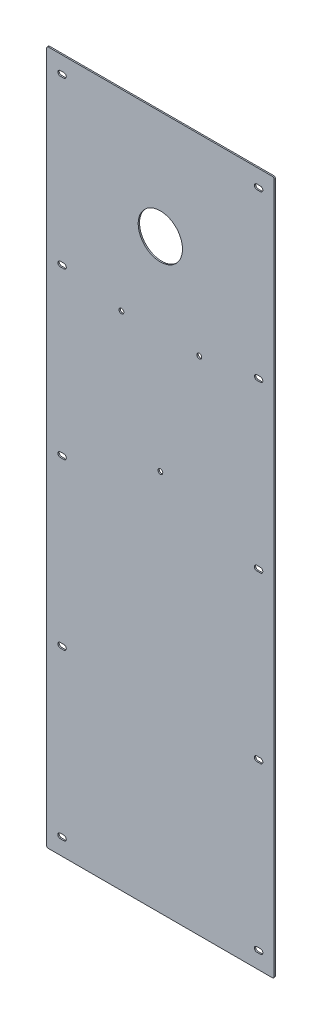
SolidWorks part; units mm, degrees
ref_plane "Ebene vorne" through (0, 0, 0) normal (0, 0, 1) x (1, 0, 0)
ref_plane "Ebene oben" through (0, 0, 0) normal (0, 1, 0) x (1, 0, 0)
ref_plane "Ebene rechts" through (0, 0, 0) normal (1, 0, 0) x (0, 0, -1)
sketch "Skizze1" plane through (0, 0, 0) normal (0, 0, 1) x (1, 0, 0)
  line L1 (-128.5, -392) -> (128.5, -392)
  line L2 (-128.5, -392) -> (-128.5, 392)
  line L3 (-128.5, 392) -> (128.5, 392)
  line L4 (128.5, -392) -> (128.5, 392)
  line L5 (-128.5, -392) -> (128.5, 392) construction
  line L6 (-128.5, 392) -> (128.5, -392) construction
  point P0 (0, 0)
  dimension "D1" = 257
  dimension "D2" = 784
extrude "Aufsatz-Linear austragen1" add sketch "Skizze1" along normal blind 1.5
sketch "Skizze2" plane through (0, 0, 1.5) normal (0, 0, 1) x (1, 0, 0)
  line L0 (128.5, 392) -> (-128.5, 392) construction
  line L1 (-89, 10) -> (89, 10)
  line L2 (-94, 15) -> (-94, 323)
  line L3 (-89, 328) -> (89, 328)
  line L4 (94, 15) -> (94, 323)
  line L5 (-94, 10) -> (94, 328) construction
  line L6 (-94, 328) -> (94, 10) construction
  arc A0 (94, 15) -> (89, 10) centre (89, 15) cw
  arc A1 (-94, 15) -> (-89, 10) centre (-89, 15) ccw
  arc A2 (94, 323) -> (89, 328) centre (89, 323) ccw
  arc A3 (-89, 328) -> (-94, 323) centre (-89, 323) ccw
  point P0 (0, 169)
  dimension "D3" = 5
  dimension "D1" = 188
  dimension "D2" = 64
  dimension "D4" = 10
extrude "Schnitt-Linear austragen1" [suppressed] cut sketch "Skizze2" against normal through all
hole_wizard "Durchgangsloch für M51" positions "Skizze3" profile "Skizze4" hole size "M5" standard "DIN"
sketch "Skizze3" plane through (0, 0, 1.5) normal (0, 0, 1) x (1, 0, 0)
  line L0 (-111, 373) -> (-111, 0) construction
  line L1 (-111, 0) -> (-111, -373) construction
  line L2 (-111, -373) -> (111, -373) construction
  line L3 (111, -373) -> (111, 0) construction
  line L4 (111, 0) -> (111, 373) construction
  line L5 (111, 373) -> (-111, 373) construction
  line L7 (0, 0) -> (0, 373) construction
  line L9 (128.5, 392) -> (-128.5, 392) construction
  line L10 (128.5, -392) -> (128.5, 392) construction
  line L11 (-128.5, -392) -> (128.5, -392) construction
  point P1 (-111, 373)
  point P2 (-111, 0)
  point P4 (-111, -373)
  point P6 (111, -373)
  point P8 (111, 0)
  point P10 (111, 373)
  point P29 (-111, -186.5)
  point P31 (111, -186.5)
  point P33 (-111, 186.5)
  point P35 (111, 186.5)
  dimension "D1" = 19
  dimension "D2" = 17.5
  dimension "D3" = 19
  dimension "D4" = 0
sketch "Skizze4" plane through (-111, 373, 1.5) normal (1, 0, 0) x (0, -1, 0)
  line L0 (0, 0) -> (0, 1.5)
  line L1 (0, 1.5) -> (2.75, 1.5)
  line L2 (2.75, 1.5) -> (2.75, 0)
  line L5 (2.75, 0) -> (0, 0)
  line L11 (0, -6.35) -> (0, 107.95) construction
  dimension "Bohrerdurchmesser" = 5.5
  dimension "Bohrungstiefe" = 1.5
sketch "Skizze13" plane through (0, 0, 1.5) normal (0, 0, 1) x (1, 0, 0)
  line L0 (-113, 373) -> (-109, 373) construction
  line L1 (-113, 375.75) -> (-109, 375.75)
  line L2 (-113, 370.25) -> (-109, 370.25)
  line L3 (-113, 186.5) -> (-109, 186.5) construction
  line L4 (-113, 189.25) -> (-109, 189.25)
  line L5 (-113, 183.75) -> (-109, 183.75)
  line L6 (-113, 0) -> (-109, 0) construction
  line L7 (-113, 2.75) -> (-109, 2.75)
  line L8 (-113, -2.75) -> (-109, -2.75)
  line L9 (-113, -186.5) -> (-109, -186.5) construction
  line L10 (-113, -183.75) -> (-109, -183.75)
  line L11 (-113, -189.25) -> (-109, -189.25)
  line L12 (-113, -373) -> (-109, -373) construction
  line L13 (-113, -370.25) -> (-109, -370.25)
  line L14 (-113, -375.75) -> (-109, -375.75)
  line L15 (0, 0) -> (0, 442.1579) construction
  line L16 (113, 373) -> (109, 373) construction
  line L17 (113, 375.75) -> (109, 375.75)
  line L18 (113, 370.25) -> (109, 370.25)
  line L19 (113, 186.5) -> (109, 186.5) construction
  line L20 (113, 189.25) -> (109, 189.25)
  line L21 (113, 183.75) -> (109, 183.75)
  line L22 (113, 0) -> (109, 0) construction
  line L23 (113, 2.75) -> (109, 2.75)
  line L24 (113, -2.75) -> (109, -2.75)
  line L25 (113, -186.5) -> (109, -186.5) construction
  line L26 (113, -183.75) -> (109, -183.75)
  line L27 (113, -189.25) -> (109, -189.25)
  line L28 (113, -373) -> (109, -373) construction
  line L29 (113, -370.25) -> (109, -370.25)
  line L30 (113, -375.75) -> (109, -375.75)
  arc A0 (-113, 375.75) -> (-113, 370.25) centre (-113, 373) ccw
  arc A1 (-109, 370.25) -> (-109, 375.75) centre (-109, 373) ccw
  circle A2 centre (-111, 373) radius 2.75 construction
  arc A3 (-113, 189.25) -> (-113, 183.75) centre (-113, 186.5) ccw
  arc A4 (-109, 183.75) -> (-109, 189.25) centre (-109, 186.5) ccw
  arc A5 (-113, 2.75) -> (-113, -2.75) centre (-113, 0) ccw
  arc A6 (-109, -2.75) -> (-109, 2.75) centre (-109, 0) ccw
  arc A7 (-113, -183.75) -> (-113, -189.25) centre (-113, -186.5) ccw
  arc A8 (-109, -189.25) -> (-109, -183.75) centre (-109, -186.5) ccw
  arc A9 (-113, -370.25) -> (-113, -375.75) centre (-113, -373) ccw
  arc A10 (-109, -375.75) -> (-109, -370.25) centre (-109, -373) ccw
  arc A11 (113, 375.75) -> (113, 370.25) centre (113, 373) cw
  arc A12 (109, 370.25) -> (109, 375.75) centre (109, 373) cw
  arc A13 (113, 189.25) -> (113, 183.75) centre (113, 186.5) cw
  arc A14 (109, 183.75) -> (109, 189.25) centre (109, 186.5) cw
  arc A15 (113, 2.75) -> (113, -2.75) centre (113, 0) cw
  arc A16 (109, -2.75) -> (109, 2.75) centre (109, 0) cw
  arc A17 (113, -183.75) -> (113, -189.25) centre (113, -186.5) cw
  arc A18 (109, -189.25) -> (109, -183.75) centre (109, -186.5) cw
  arc A19 (113, -370.25) -> (113, -375.75) centre (113, -373) cw
  arc A20 (109, -375.75) -> (109, -370.25) centre (109, -373) cw
  point P2 (-111, 373)
  point P12 (-111, 186.5)
  point P19 (-111, 0)
  point P28 (-111, -186.5)
  point P36 (-111, -373)
  point P48 (111, 373)
  point P55 (111, 186.5)
  point P62 (111, 0)
  point P69 (111, -186.5)
  point P76 (111, -373)
  dimension "D1" = 4
extrude "Schnitt-Linear austragen6" cut sketch "Skizze13" against normal through all
sketch "Skizze5" plane through (0, 0, 1.5) normal (0, 0, 1) x (1, 0, 0)
  line L0 (0, 0) -> (0, -392) construction
  line L1 (-128.5, -392) -> (128.5, -392) construction
  line L3 (-46, -392) -> (46, -392)
  line L4 (-46, -392) -> (-46, -319)
  line L5 (-41, -314) -> (41, -314)
  line L6 (46, -392) -> (46, -319)
  arc A0 (46, -319) -> (41, -314) centre (41, -319) ccw
  arc A1 (-41, -314) -> (-46, -319) centre (-41, -319) ccw
  point P12 (46, -314)
  point P15 (-46, -314)
  dimension "D3" = 5
  dimension "D1" = 78
  dimension "D2" = 92
extrude "Schnitt-Linear austragen2" [suppressed] cut sketch "Skizze5" against normal through all
fillet "Verrundung1" [suppressed] radius 2
fillet "Verrundung2" radius 2 4 edges at (128.5, -392, 0.75) (-128.5, -392, 0.75) (-128.5, 392, 0.75) (128.5, 392, 0.75)
sketch "Skizze7" plane through (0, 0, 1.5) normal (0, 0, 1) x (1, 0, 0)
  circle A0 centre (0, 270) radius 25
  dimension "D1" = 270
  dimension "D2" = 50
extrude "Schnitt-Linear austragen4" cut sketch "Skizze7" against normal through all
sketch "Skizze10" [suppressed] plane through (0, 0, 1.5) normal (0, 0, 1) x (1, 0, 0)
  line L0 (-126.5, -392) -> (126.5, -392) construction
  circle A0 centre (0, -242) radius 6.7
  dimension "D1" = 13.4
  dimension "D2" = 150
extrude "Schnitt-Linear austragen5" [suppressed] cut sketch "Skizze10" against normal through all
hole_wizard "Durchgangsloch für M52" positions "Skizze11" profile "Skizze12" hole size "M5" standard "DIN"
sketch "Skizze11" plane through (0, 0, 1.5) normal (0, 0, 1) x (1, 0, 0)
  line L0 (0, -127.8832) -> (0, 40) construction
  line L1 (0, 40) -> (44, 175) construction
  line L2 (44, 175) -> (-44, 175) construction
  line L3 (-44, 175) -> (0, 40) construction
  point P2 (0, 40)
  point P4 (44, 175)
  point P6 (-44, 175)
  dimension "D1" = 88
  dimension "D2" = 135
  dimension "D3" = 40
sketch "Skizze12" plane through (-44, 175, 1.5) normal (1, 0, 0) x (0, -1, 0)
  line L0 (0, 0) -> (0, 1.5)
  line L1 (0, 1.5) -> (2.75, 1.5)
  line L2 (2.75, 1.5) -> (2.75, 0)
  line L5 (2.75, 0) -> (0, 0)
  line L11 (0, -6.35) -> (0, 107.95) construction
  dimension "Bohrerdurchmesser" = 5.5
  dimension "Bohrungstiefe" = 1.5
